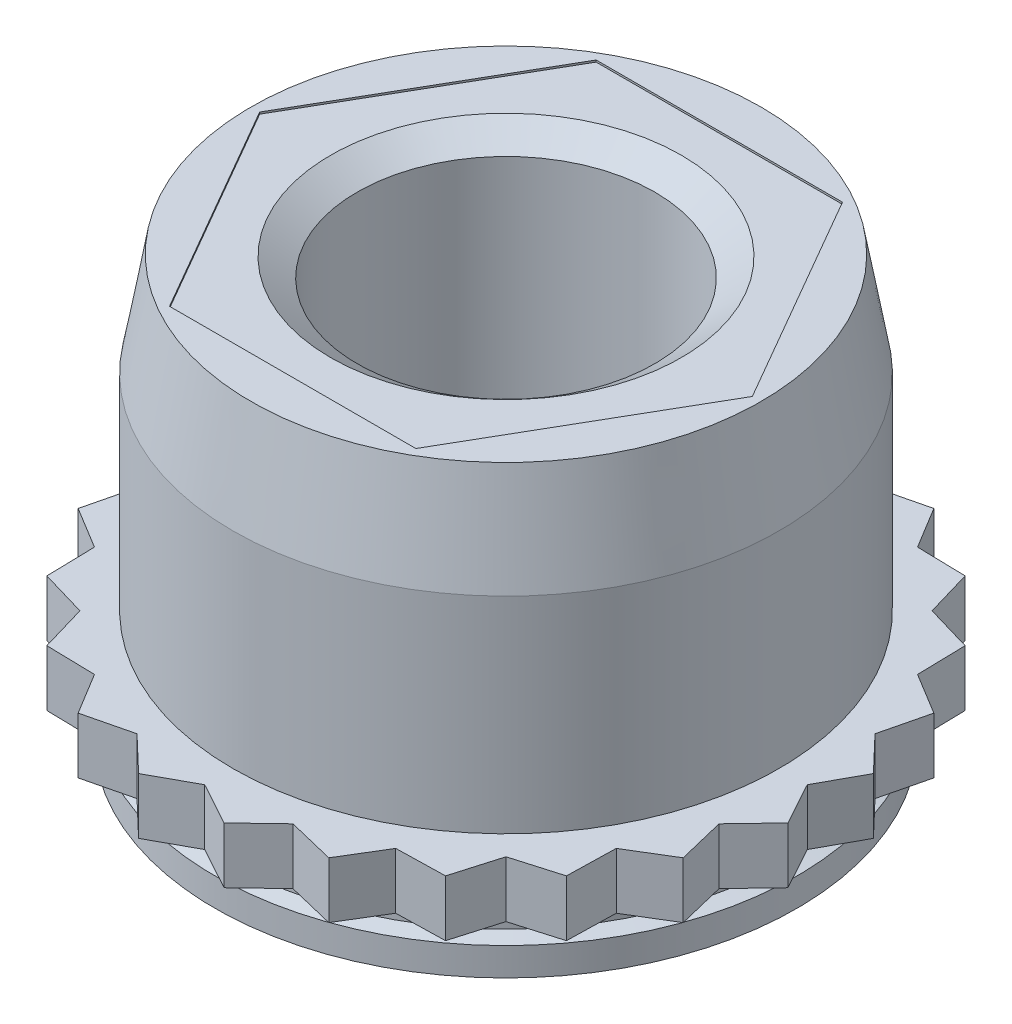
SolidWorks part; units mm, degrees
ref_plane "Plane1" through (0, 0, 0) normal (0, 0, 1) x (1, 0, 0)
ref_plane "Plane2" through (0, 0, 0) normal (0, 1, 0) x (1, 0, 0)
ref_plane "Plane3" through (0, 0, 0) normal (1, 0, 0) x (0, 0, -1)
sketch "BodySke" plane through (0, 0, 0) normal (0, 0, 1) x (1, 0, 0)
  line L0 (3.7522, -1.0901) -> (3.7522, -0.762)
  line L1 (3.7084, 2.794) -> (3.4621, 4.191)
  line L2 (4.445, 0) -> (3.7084, 0)
  line L3 (2.0193, 4.191) -> (2.0193, -1.524)
  line L4 (2.0193, -1.524) -> (3.9497, -1.524)
  line L5 (3.9497, -1.524) -> (3.9497, -1.143)
  line L6 (3.9497, -1.143) -> (3.7522, -1.0901)
  line L7 (1.016, 0.7925) -> (3.7084, 0.7925) construction
  line L8 (3.7084, 0) -> (3.7084, 2.794)
  line L9 (0, 0) -> (0, 15.24) construction
  line L11 (3.4621, 4.191) -> (2.0193, 4.191)
  line L15 (3.7522, -0.762) -> (4.445, -0.762)
  line L16 (4.445, -0.762) -> (4.445, 0)
  dimension "D1" = 10
  dimension "D2" = 75
  dimension "C_dia" = 7.8994
  dimension "A_ht" = 1.524
  dimension "Thread_min" = 4.0386
  dimension "Clinch_dia" = 8.89
  dimension "C_len" = 0.381
  dimension "Clinching_ht" = 0.762
  dimension "Advance" = 0.7925
  dimension "D_dia" = 7.4168
  dimension "Height" = 4.191
  dimension "Groove_dia" = 7.5044
  dimension "Chamfer_ht" = 1.397
revolve "Body" add sketch "BodySke"
revolve "EndChamfer" cut sketch "EndChamferSke" angle 360 about L0
sketch "EndChamferSke" plane through (0, 0, 0) normal (0, 0, 1) x (1, 0, 0)
  line L0 (0, -2.54) -> (0, 7.62) construction
  line L1 (0, 0) -> (0, 15.24) construction
  line L2 (2.413, -1.778) -> (2.413, -1.5215)
  line L3 (2.413, -1.5215) -> (2.0193, -1.2459)
  line L4 (2.0193, -1.2459) -> (2.0193, -1.778)
  line L5 (2.0193, -1.778) -> (2.413, -1.778)
  line L6 (2.413, 4.1885) -> (2.413, 4.445)
  line L7 (2.413, 4.445) -> (2.0193, 4.445)
  line L8 (2.0193, 4.445) -> (2.0193, 3.9129)
  line L9 (2.0193, 3.9129) -> (2.413, 4.1885)
  line L10 (3.4621, 4.191) -> (-3.4621, 4.191) construction
  line L11 (-3.9497, -1.524) -> (3.9497, -1.524) construction
  line L12 (2.0193, 4.191) -> (-2.0193, 4.191) construction
  dimension "D1" = 0.254
  dimension "Thread_nominal" = 4.826
  dimension "D2" = 34.99
  dimension "D3" = 0.254
  dimension "Thread_min" = 4.0386
  dimension "Inset" = 0.0025
  dimension "Inset_far" = 0.0025
ref_plane "Plane4" through (0, -0.5486, 0) normal (0, 1, 0) x (-1, 0, 0)
sketch "ThdSchSke" plane through (0, 0, 0) normal (0, 0, 1) x (1, 0, 0)
  line L0 (0, -5.08) -> (0, 7.62) construction
  line L1 (0, 0) -> (0, 15.24) construction
  line L2 (0, -1.5215) -> (2.413, -1.5215) construction
  line L4 (2.413, -1.5215) -> (2.0193, -1.2458)
  line L6 (2.413, -1.5215) -> (2.0193, -1.7971)
  line L7 (2.0193, -1.2458) -> (2.0193, -1.7971)
  line L8 (2.413, -1.5215) -> (-2.413, -1.5215) construction
  dimension "Vee_angle" = 70
  dimension "Thread_nominal" = 4.826
  dimension "Thread_min" = 4.0386
revolve "ThreadSchematic" [suppressed] cut sketch "ThdSchSke" angle 360 about L0
pattern_linear "ThdSchPat" [suppressed]
sketch "CliRinCutSke" plane through (0, -0.762, 0) normal (0, -1, 0) x (1, 0, 0)
  line L0 (0.5802, 4.407) -> (0, 4.0894)
  line L1 (0, 4.0894) -> (-0.5802, 4.407)
  line L2 (0, 0) -> (0, 5.842) construction
  arc A1 (0.5802, 4.407) -> (-0.5802, 4.407) centre (0, 0) ccw
  circle A2 centre (0, 0) radius 4.0894 construction
  dimension "Clinch_dia" = 8.89
  dimension "Clinch_minor" = 8.1788
  dimension "Angle" = 15
extrude "ClinchCut" cut sketch "CliRinCutSke" against normal blind 0.762
pattern_circular "ClinchCutPat" count 24 every 15 about axis through (0, 0, 0) along (0, 1, 0) of "ClinchCut"
sketch "HexCutSke" plane through (0, 4.191, 0) normal (0, 1, 0) x (-1, 0, 0)
  line L0 (-1.6718, 2.8956) -> (1.6718, 2.8956)
  line L1 (1.6718, 2.8956) -> (3.3436, 0)
  line L2 (3.3436, 0) -> (1.6718, -2.8956)
  line L3 (1.6718, -2.8956) -> (-1.6718, -2.8956)
  line L4 (-1.6718, -2.8956) -> (-3.3436, 0)
  line L5 (-3.3436, 0) -> (-1.6718, 2.8956)
  circle A0 centre (0, 0) radius 3.3436 construction
  circle A1 centre (0, 0) radius 2.8956 construction
  dimension "Width_across_flats" = 5.7912
extrude "HexCut" cut sketch "HexCutSke" against normal blind 0.0254
equation "' \"A_ht@BodySke\" = 0.06"
equation "' \"C_dia@BodySke\" = 0.311"
equation "' \"D_dia@BodySke\" = 0.292"
equation "' \"Clinch_dia@BodySke\" = 0.35"
equation "' \"Height@BodySke\" = 0.165"
equation "' \"Advance@BodySke\" = 0.0312"
equation "' \"Thread_min@BodySke\" = 0.159"
equation "' \"Thread_nominal@ThreadCosmetic\" = 0.19"
equation "\"Width_across_flats@HexCutSke\" = \"Thread_nominal@ThreadCosmetic\" * 1.2"
equation "\"Count@ClinchCutPat\" = 24"
equation "\"Angle@ClinchCutPat\" = 360 / \"Count@ClinchCutPat\""
equation "\"Angle@CliRinCutSke\" = 360 / \"Count@ClinchCutPat\""
equation "\"Clinch_dia@CliRinCutSke\" = \"Clinch_dia@BodySke\""
equation "\"Clinch_minor@CliRinCutSke\" = \"Clinch_dia@BodySke\" * 0.92"
equation "\"C_len@BodySke\" = \"A_ht@BodySke\" * 0.25"
equation "\"Groove_dia@BodySke\" = \"C_dia@BodySke\" * 0.95"
equation "\"Clinching_ht@BodySke\" = \"A_ht@BodySke\" * 0.5"
equation "\"Depth@ClinchCut\" =  \"A_ht@BodySke\" * 0.5"
equation "\"Chamfer_ht@BodySke\" = \"Height@BodySke\" / 3"
equation "\"Thread_nominal@EndChamferSke\" = \"Thread_nominal@ThreadCosmetic\""
equation "\"Thread_min@EndChamferSke\" = \"Thread_min@BodySke\""
equation "\"D2@EndChamferSke\" = \"Vee_angle@ThdSchSke\" / 2 - 0.01"
equation "\"Thread_nominal@ThdSchSke\" = \"Thread_nominal@ThreadCosmetic\""
equation "\"Thread_min@ThdSchSke\" = \"Thread_min@BodySke\""
equation "\"Num_threads@ThdSchPat\" = int(  ( \"Height@BodySke\" + \"A_ht@BodySke\" - \"Inset@EndChamferSke\" - \"Inset_far@EndChamferSke\" ) / \"Advance@BodySke\" + 0.999 )  + 1"
equation "\"Advance@ThdSchPat\" = ( \"Height@BodySke\" + \"A_ht@BodySke\" - \"Inset@EndChamferSke\" - \"Inset_far@EndChamferSke\" ) /  (\"Num_threads@ThdSchPat\" - 1) 'relax it"
